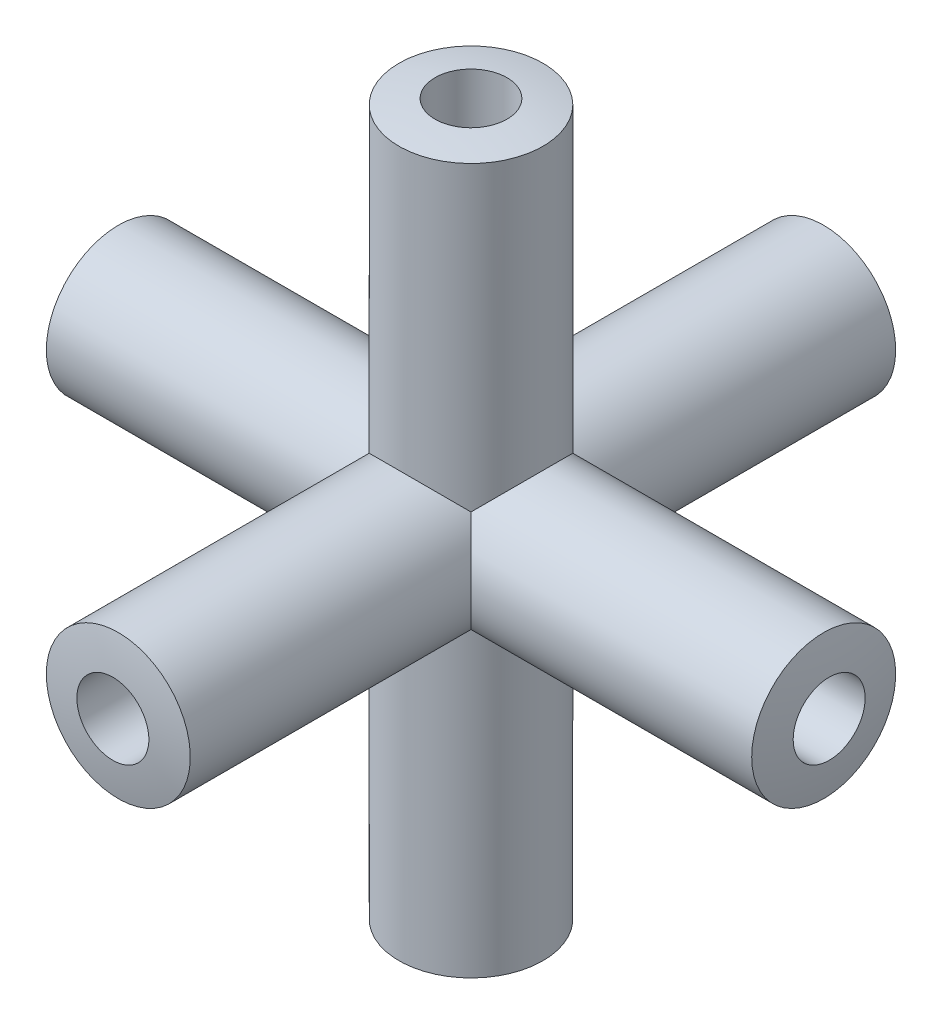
SolidWorks part; units mm, degrees
ref_plane "Front Plane" through (0, 0, 0) normal (0, 0, 1) x (1, 0, 0)
ref_plane "Top Plane" through (0, 0, 0) normal (0, 1, 0) x (1, 0, 0)
ref_plane "Right Plane" through (0, 0, 0) normal (1, 0, 0) x (0, 0, -1)
sketch "Sketch1" plane through (0, 0, 0) normal (0, 0, 1) x (1, 0, 0)
  circle A0 centre (0, 0) radius 10
  circle A1 centre (0, 0) radius 5
  dimension "D1" = 20
  dimension "D2" = 10
extrude "Boss-Extrude1" add sketch "Sketch1" along normal mid plane 100
sketch "Sketch2" plane through (0, 0, 0) normal (0, 1, 0) x (1, 0, 0)
  circle A0 centre (0, 0) radius 10
  circle A1 centre (0, 0) radius 5
  dimension "D1" = 20
  dimension "D2" = 10
extrude "Boss-Extrude2" add sketch "Sketch2" along normal mid plane 100
sketch "Sketch3" plane through (0, 0, 0) normal (1, 0, 0) x (0, 0, -1)
  circle A0 centre (0, 0) radius 5
  circle A1 centre (0, 0) radius 10
  dimension "D1" = 20
  dimension "D2" = 10
extrude "Boss-Extrude3" add sketch "Sketch3" along normal mid plane 100
sketch "Sketch4" plane through (0, 50, 0) normal (0, 1, 0) x (1, 0, 0)
  circle A0 centre (0, 0) radius 5 construction
  circle A1 centre (0, 0) radius 5
extrude "Cut-Extrude1" cut sketch "Sketch4" against normal through all
sketch "Sketch5" plane through (0, 0, 50) normal (0, 0, 1) x (1, 0, 0)
  circle A0 centre (0, 0) radius 5 construction
  circle A1 centre (0, 0) radius 5
extrude "Cut-Extrude2" cut sketch "Sketch5" against normal through all
sketch "Sketch6" plane through (50, 0, 0) normal (1, 0, 0) x (0, 0, -1)
  circle A0 centre (0, 0) radius 5 construction
  circle A1 centre (0, 0) radius 5
extrude "Cut-Extrude3" cut sketch "Sketch6" against normal through all
sketch "Sketch7" plane through (0, 0, 0) normal (0, 0, 1) x (1, 0, 0)
  line L0 (0, -50) -> (0, 50) construction
  line L1 (0, 50) -> (0, 55)
  line L2 (0, -55) -> (0, -50)
  line L6 (-50, 10) -> (-50, -10) construction
  arc A0 (0, 55) -> (0, -55) centre (0, 0) ccw
  arc A2 (0, -50) -> (0, 50) centre (0, 0) cw
  point P6 (-50, 0)
  dimension "D1" = 5
revolve "Cut-Revolve1" cut sketch "Sketch7" angle 360 about L0
sketch "Sketch8" plane through (0, 0, 0) normal (0, 0, 1) x (1, 0, 0)
  line L0 (0, 25) -> (0, 0) construction
  line L2 (-5, 25) -> (-6, 25)
  line L3 (-6, 25) -> (-6, 20)
  line L4 (-6, 20) -> (-5, 20)
  line L5 (-5, 20) -> (-5, 25)
  dimension "D1" = 25
  dimension "D2" = 5
  dimension "D3" = 1
  dimension "D4" = 5
revolve "Cut-Revolve2" cut sketch "Sketch8" angle 360 about L0
pattern_circular "CirPattern1" count 2 over 360 of "Cut-Revolve2"
pattern_circular "CirPattern2" count 2 over 90 of "Cut-Revolve2", "CirPattern1"
pattern_circular "CirPattern3" count 2 over 90 of "CirPattern2"
scale "Scale1" scale about centroid uniform scaling yes scale factor 0.75
